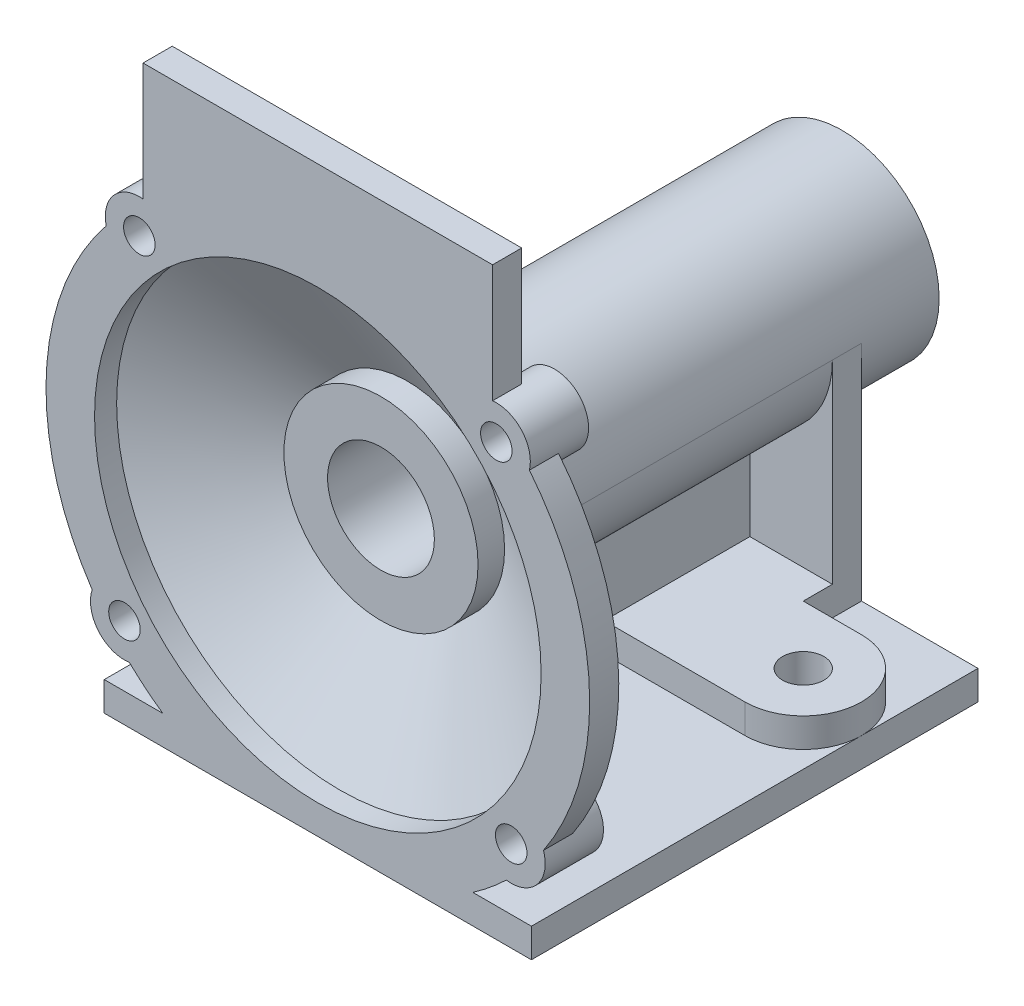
SolidWorks part; units mm, degrees
ref_plane "Front" through (0, 0, 0) normal (0, 0, 1) x (1, 0, 0)
ref_plane "Top" through (0, 0, 0) normal (0, 1, 0) x (1, 0, 0)
ref_plane "Right" through (0, 0, 0) normal (1, 0, 0) x (0, 0, -1)
sketch "Sketch1" plane through (0, 0, 0) normal (1, 0, 0) x (0, 0, -1)
  line L0 (0, 0) -> (89.8884, 0) construction
  line L1 (0, -73.025) -> (0, -88.9)
  line L2 (0, -88.9) -> (9.525, -88.9)
  line L3 (9.525, -88.9) -> (40.1411, -31.75)
  line L4 (40.1411, -31.75) -> (171.45, -31.75)
  line L5 (171.45, -31.75) -> (171.45, -17.4625)
  line L6 (171.45, -17.4625) -> (120.65, -17.4625)
  line L7 (120.65, -17.4625) -> (120.65, -20.6375)
  line L8 (120.65, -20.6375) -> (69.85, -20.6375)
  line L9 (69.85, -20.6375) -> (69.85, -17.4625)
  line L10 (69.85, -17.4625) -> (20.6502, -17.4625)
  line L11 (20.6502, -17.4625) -> (20.6502, -31.75)
  line L12 (20.6502, -31.75) -> (29.3354, -31.75)
  line L13 (29.3354, -31.75) -> (7.2238, -73.025)
  line L14 (7.2238, -73.025) -> (0, -73.025)
  point P5 (57.15, 0)
  dimension "D1" = 34.925
  dimension "D2" = 41.275
  dimension "D3" = 50.8
  dimension "D4" = 50.8
  dimension "D5" = 63.5
  dimension "D6" = 146.05
  dimension "D7" = 177.8
  dimension "D8" = 9.525
  dimension "D9" = 9.525
  dimension "D10" = 20.6502
  dimension "D11" = 171.45
  dimension "D12" = 57.15
revolve "Revolve1" add sketch "Sketch1" angle 360 about L0
sketch "Sketch2" plane through (0, 0, 0) normal (0, 0, 1) x (1, 0, 0)
  line L0 (0, 0) -> (0, 144.1236) construction
  line L1 (-57.15, 68.0962) -> (-26.3735, 68.0962)
  line L2 (-57.15, 68.0962) -> (-57.15, 107.95)
  line L3 (-57.15, 107.95) -> (57.15, 107.95)
  line L4 (57.15, 68.0962) -> (57.15, 107.95)
  line L5 (26.3735, 68.0962) -> (57.15, 68.0962)
  circle A0 centre (0, 0) radius 88.9 construction
  circle A1 centre (0, 0) radius 73.025 construction
  arc A2 (26.3735, 68.0962) -> (-26.3735, 68.0962) centre (0, 0) ccw
  dimension "D1" = 114.3
  dimension "D2" = 107.95
extrude "Extrude1" add sketch "Sketch2" against normal blind 9.525
sketch "Sketch3" plane through (0, 0, 0) normal (0, 0, 1) x (1, 0, 0)
  line L0 (0, 0) -> (105.8426, 0) construction
  line L1 (0, 0) -> (73.9921, 73.9921) construction
  line L2 (49.9927, 65.6904) -> (43.7106, 58.4982)
  line L3 (65.6904, 49.9927) -> (58.4982, 43.7106)
  circle A0 centre (0, 0) radius 82.55 construction
  arc A1 (49.9927, 65.6904) -> (65.6904, 49.9927) centre (58.3717, 58.3717) cw
  circle A2 centre (0, 0) radius 73.025 construction
  circle A3 centre (0, 0) radius 73.025 construction
  arc A4 (58.4982, 43.7106) -> (43.7106, 58.4982) centre (0, 0) ccw
  dimension "D2" = 165.1
  dimension "D3" = 11.1252
  dimension "D1" = 45
extrude "Extrude2" add sketch "Sketch3" against normal blind 19.05
sketch "Sketch4" plane through (0, 0, -19.05) normal (0, 0, -1) x (-1, 0, 0)
  circle A0 centre (-58.3717, 58.3717) radius 5.1562
  dimension "D1" = 10.3124
extrude "Extrude3" cut sketch "Sketch4" against normal through all
pattern_circular "CirPattern1" count 2 every 85 about axis through (0, 0, 0) along (0, 0, 1) of "Extrude2", "Extrude3"
mirror "Mirror1" about plane through (0, 0, 0) normal (1, 0, 0) of "CirPattern1", "Extrude2", "Extrude3"
other "DeleteFace1"
ref_plane "Plane1" through (0, -82.55, 0) normal (0, 1, 0) x (-1, 0, 0)
other "SurfaceCut1"
sketch "Sketch5" plane through (0, -82.55, 0) normal (0, 1, 0) x (-1, 0, 0)
  line L0 (0, -146.05) -> (0, 0) construction
  line L1 (-69.85, 0) -> (69.85, 0)
  line L2 (-69.85, 0) -> (-69.85, -146.05)
  line L3 (-69.85, -146.05) -> (69.85, -146.05)
  line L4 (69.85, 0) -> (69.85, -146.05)
  dimension "D1" = 139.7
  dimension "D2" = 146.05
extrude "Extrude4" add sketch "Sketch5" along normal blind 9.525
sketch "Sketch8" plane through (0, 0, -146.05) normal (0, 0, -1) x (-1, 0, 0)
  line L0 (0, -73.025) -> (0, -31.75)
  line L1 (-69.85, -73.025) -> (69.85, -73.025) construction
  circle A0 centre (0, 0) radius 31.75 construction
rib "Rib2" sketch "Sketch8" sketch "Sketch8" thickness 9.525 extrusion direction normal to sketch draft on no parameters "D1"=9.525
sketch "Sketch9" plane through (0, 0, -146.05) normal (0, 0, -1) x (-1, 0, 0)
  line L0 (-31.75, 0) -> (-31.75, -73.025)
  line L4 (-4.7625, -73.025) -> (-50.7007, -73.025) construction
  line L6 (31.75, 0) -> (31.75, -73.025)
  line L7 (50.7007, -73.025) -> (4.7625, -73.025) construction
  line L8 (-31.75, -73.025) -> (31.75, -73.025)
  arc A4 (4.7625, -31.3908) -> (-4.7625, -31.3908) centre (0, 0) ccw construction
  circle A5 centre (0, 0) radius 31.75 construction
  arc A6 (-31.75, 0) -> (31.75, 0) centre (0, 0) ccw
extrude "Extrude5" add sketch "Sketch9" against normal blind 9.525
sketch "Sketch10" plane through (0, 0, 0) normal (1, 0, 0) x (0, 0, -1)
  line L0 (0, -49.5673) -> (0, -64.1873) construction
  line L1 (0, -82.55) -> (146.05, -82.55) construction
  circle A0 centre (63.5, -53.975) radius 12.7
  dimension "D1" = 25.4
  dimension "D2" = 63.5
  dimension "D3" = 28.575
extrude "Extrude6" cut sketch "Sketch10" against normal through all and the other way through all
sketch "Sketch11" plane through (0, -73.025, 0) normal (0, 1, 0) x (1, 0, 0)
  line L0 (31.75, 146.05) -> (4.7625, 146.05)
  line L1 (31.75, 146.05) -> (-31.75, 146.05) construction
  line L2 (4.7625, 146.05) -> (4.7625, 88.9)
  line L3 (4.7625, 136.525) -> (4.7625, 40.1411) construction
  line L4 (4.7625, 88.9) -> (50.8, 88.9)
  line L5 (50.8, 127) -> (31.75, 127)
  line L6 (31.75, 40.1411) -> (31.75, 136.525) construction
  line L7 (31.75, 127) -> (31.75, 146.05)
  line L8 (69.85, 0) -> (69.85, 146.05) construction
  line L10 (57.15, 0) -> (-57.15, 0) construction
  arc A0 (50.8, 88.9) -> (50.8, 127) centre (50.8, 107.95) ccw
  dimension "D1" = 50.8
  dimension "D2" = 107.95
extrude "Extrude7" add sketch "Sketch11" along normal blind 9.525
sketch "Sketch12" plane through (0, -63.5, 0) normal (0, 1, 0) x (1, 0, 0)
  circle A0 centre (50.8, 107.95) radius 6.7437
  dimension "D1" = 13.4874
extrude "Extrude8" cut sketch "Sketch12" against normal through all
mirror "Mirror2" about plane through (0, 0, 0) normal (1, 0, 0) of "Extrude8", "Extrude7"
ref_plane "Plane2" through (0, 31.75, -105.7955) normal (0, 1, 0) x (-1, 0, 0)
sketch "Sketch13" plane through (0, 31.75, -105.7955) normal (0, 1, 0) x (-1, 0, 0)
  line L0 (0, 44.0417) -> (0, 112.0674) construction
  line L1 (-11.1252, 65.6545) -> (11.1252, 65.6545)
  line L2 (-31.75, 65.6545) -> (31.75, 65.6545) construction
  line L3 (11.1252, 65.6545) -> (11.1252, 61.3455)
  line L4 (-11.1252, 61.3455) -> (-11.1252, 65.6545)
  line L5 (-20.6375, 35.9455) -> (20.6375, 35.9455) construction
  arc A0 (11.1252, 61.3455) -> (-11.1252, 61.3455) centre (0, 61.3455) cw
  dimension "D1" = 11.1252
  dimension "D2" = 25.4
extrude "Extrude9" add sketch "Sketch13" along normal blind 6.35 and the other way up to next
other "DeleteFace2"
